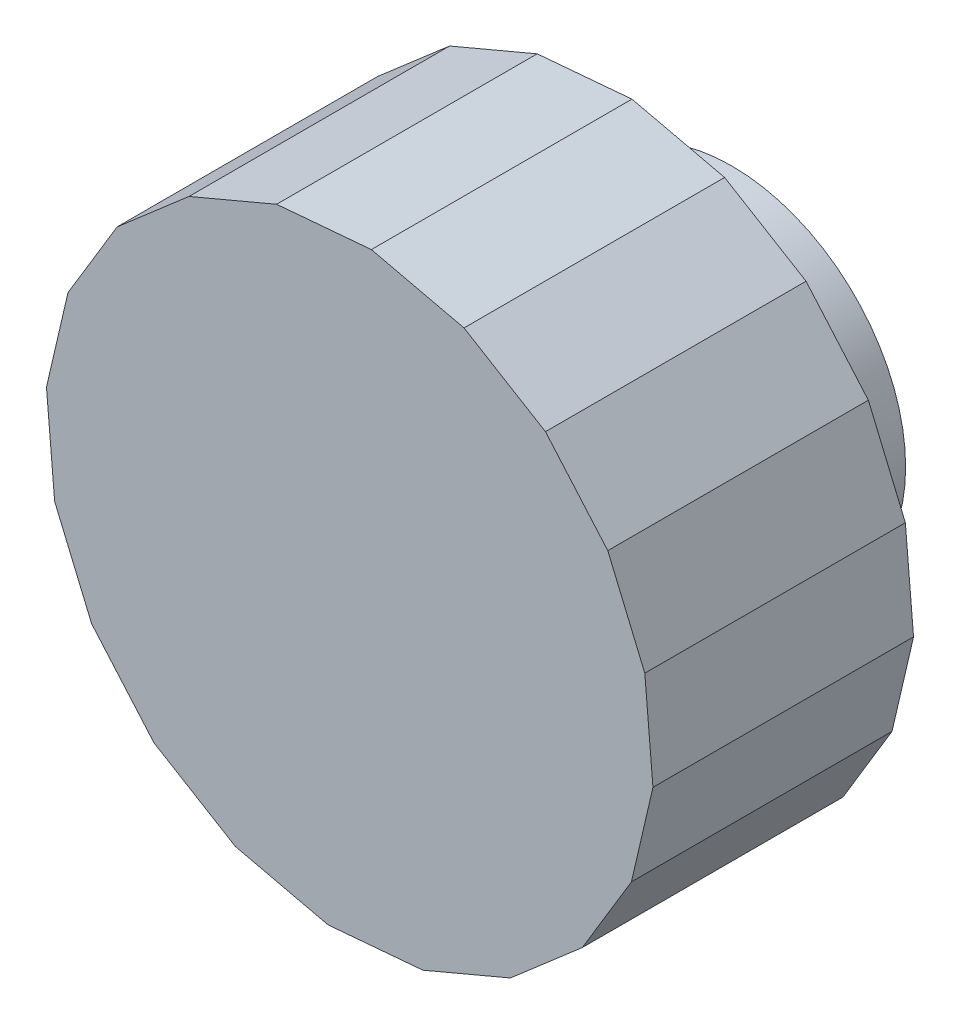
SolidWorks part; units mm, degrees
ref_plane "Alzado" through (0, 0, 0) normal (0, 0, 1) x (1, 0, 0)
ref_plane "Planta" through (0, 0, 0) normal (0, 1, 0) x (1, 0, 0)
ref_plane "Vista lateral" through (0, 0, 0) normal (1, 0, 0) x (0, 0, -1)
sketch "Croquis1" plane through (0, 0, 0) normal (0, 0, 1) x (1, 0, 0)
  circle A0 centre (0, 0) radius 10
  dimension "D1" = 20
extrude "Saliente-Extruir1" add sketch "Croquis1" along normal blind 7
sketch "Croquis2" plane through (0, 0, 7) normal (0, 0, 1) x (1, 0, 0)
  line L1 (6.5798, 16.2159) -> (1.2467, 17.4555)
  line L2 (1.2467, 17.4555) -> (-4.2083, 16.9865)
  line L3 (-4.2083, 16.9865) -> (-9.2515, 14.8546)
  line L4 (-9.2515, 14.8546) -> (-13.389, 11.2687)
  line L5 (-13.389, 11.2687) -> (-16.2159, 6.5798)
  line L6 (-16.2159, 6.5798) -> (-17.4555, 1.2467)
  line L7 (-17.4555, 1.2467) -> (-16.9865, -4.2083)
  line L8 (-16.9865, -4.2083) -> (-14.8546, -9.2515)
  line L9 (-14.8546, -9.2515) -> (-11.2687, -13.389)
  line L10 (-11.2687, -13.389) -> (-6.5798, -16.2159)
  line L11 (-6.5798, -16.2159) -> (-1.2467, -17.4555)
  line L12 (-1.2467, -17.4555) -> (4.2083, -16.9865)
  line L13 (4.2083, -16.9865) -> (9.2515, -14.8546)
  line L14 (9.2515, -14.8546) -> (13.389, -11.2687)
  line L15 (13.389, -11.2687) -> (16.2159, -6.5798)
  line L16 (16.2159, -6.5798) -> (17.4555, -1.2467)
  line L17 (17.4555, -1.2467) -> (16.9865, 4.2083)
  line L18 (16.9865, 4.2083) -> (14.8546, 9.2515)
  line L19 (14.8546, 9.2515) -> (11.2687, 13.389)
  line L20 (11.2687, 13.389) -> (6.5798, 16.2159)
  circle A0 centre (0, 0) radius 17.5 construction
  dimension "D1" = 35
extrude "Saliente-Extruir2" add sketch "Croquis2" along normal blind 15
sketch "Croquis3" plane through (0, 0, 0) normal (0, 0, -1) x (-1, 0, 0)
  circle A0 centre (0, 0) radius 4
  dimension "D1" = 8
extrude "Cortar-Extruir1" cut sketch "Croquis3" against normal blind 17
sketch "Croquis4" plane through (0, 0, 0) normal (0, 0, -1) x (-1, 0, 0)
  line L0 (0, 10) -> (0, 4)
  line L2 (-2.75, 5.5) -> (2.75, 5.5)
  line L3 (-2.75, 5.5) -> (-2.75, 8.5)
  line L4 (-2.75, 8.5) -> (2.75, 8.5)
  line L5 (2.75, 5.5) -> (2.75, 8.5)
  line L6 (-2.75, 5.5) -> (2.75, 8.5) construction
  line L7 (-2.75, 8.5) -> (2.75, 5.5) construction
  circle A0 centre (0, 0) radius 10 construction
  circle A1 centre (0, 0) radius 10 construction
  circle A2 centre (0, 0) radius 4 construction
  point P9 (0, 7)
  dimension "D1" = 5.5
  dimension "D2" = 3
extrude "Cortar-Extruir2" cut sketch "Croquis4" against normal blind 6 contours L2 L5 L4 L0 | L4 L3 L2 L0
sketch "Croquis5" plane through (0, 8.5, 0) normal (0, -1, 0) x (-1, 0, 0)
  line L0 (0, -7) -> (0, 0) construction
  line L1 (10, -7) -> (-10, -7) construction
  circle A0 centre (0, -3.5) radius 1.5
  dimension "D1" = 3
extrude "Cortar-Extruir3" cut sketch "Croquis5" along normal blind 6 and the other way blind 2
